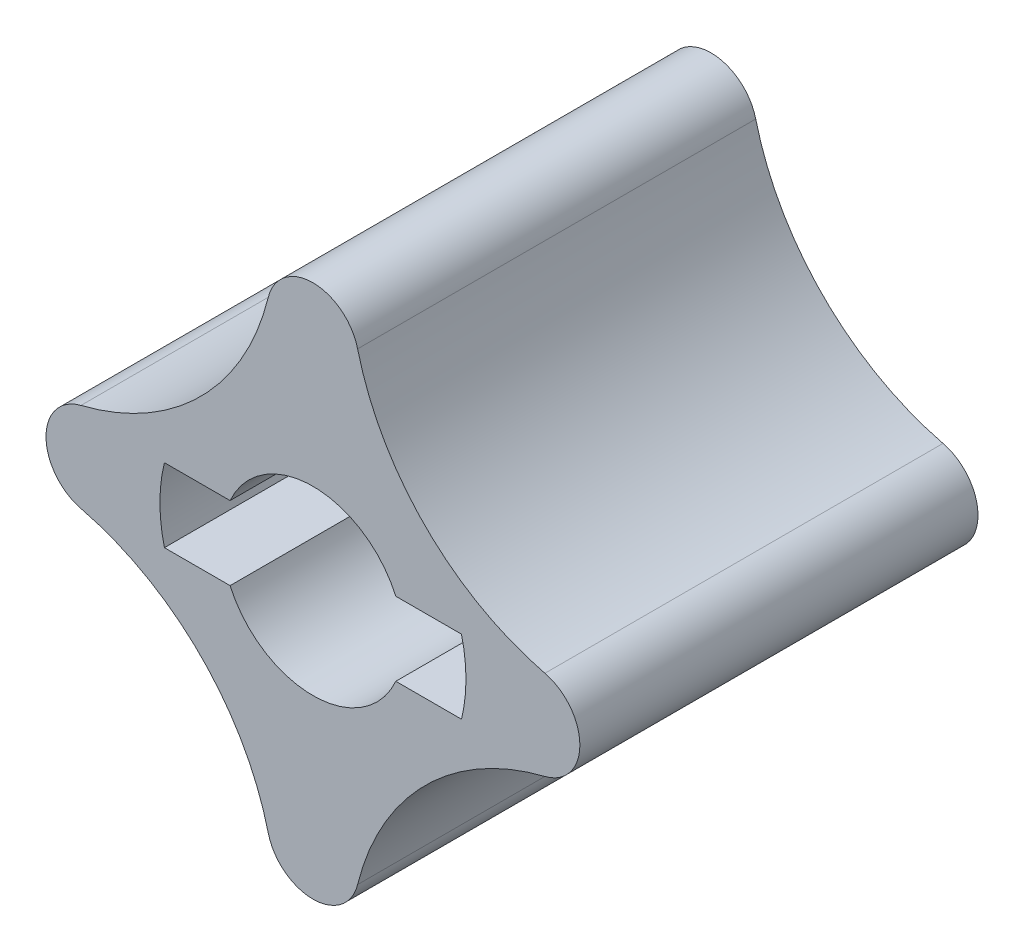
SolidWorks part; units mm, degrees
extrude "Base-Extrude" add sketch "Sketch1" along normal blind 21.971
sketch "Sketch1" plane through (0, 0, 0) normal (0, 0, 1) x (1, 0, 0)
  line L0 (0, 12.192) -> (0, -12.192) construction
  line L1 (-12.192, 0) -> (12.192, 0) construction
  line L8 (50, 0) -> (-50, 0) construction
  arc A2 (2.4657, 12.802) -> (-2.4657, 12.802) centre (0, 12.192) ccw
  arc A3 (12.802, -2.4657) -> (12.802, 2.4657) centre (12.192, 0) ccw
  arc A4 (-2.4657, -12.802) -> (2.4657, -12.802) centre (0, -12.192) ccw
  arc A5 (-12.802, 2.4657) -> (-12.802, -2.4657) centre (-12.192, 0) ccw
  arc A6 (2.4657, 12.802) -> (12.802, 2.4657) centre (16.1995, 16.1995) ccw
  arc A8 (-12.802, -2.4657) -> (-2.4657, -12.802) centre (-16.1995, -16.1995) cw
  arc A9 (-2.4657, 12.802) -> (-12.802, 2.4657) centre (-16.1995, 16.1995) cw
  arc A10 (12.802, -2.4657) -> (2.4657, -12.802) centre (16.1995, -16.1995) ccw
  circle A11 centre (0, 0) radius 5.0038
  dimension "D1" = 14.1478
  dimension "D2" = 5.08
  dimension "D3" = 24.384
  dimension "D4" = 10.0076
extrude "Cut-Extrude1" cut sketch "Sketch2" against normal blind 15.113
sketch "Sketch2" plane through (0, 0, 21.971) normal (0, 0, 1) x (1, 0, 0)
  line L0 (-8.1974, 2.032) -> (8.1974, 2.032)
  line L1 (-8.1974, -2.032) -> (8.1974, -2.032)
  arc A0 (-8.1974, 2.032) -> (-8.1974, -2.032) centre (0, 0) ccw
  arc A2 (8.1974, -2.032) -> (8.1974, 2.032) centre (0, 0) ccw
  circle A3 centre (0, 0) radius 5.0038 construction
  dimension "D1" = 16.891
  dimension "D2" = 4.064
ref_plane "Plane1" through (0, 0, 0) normal (0, 0, 1) x (1, 0, 0)
ref_plane "Plane2" through (0, 0, 0) normal (0, 1, 0) x (-1, 0, 0)
ref_plane "Plane3" through (0, 0, 0) normal (1, 0, 0) x (0, 0, -1)
